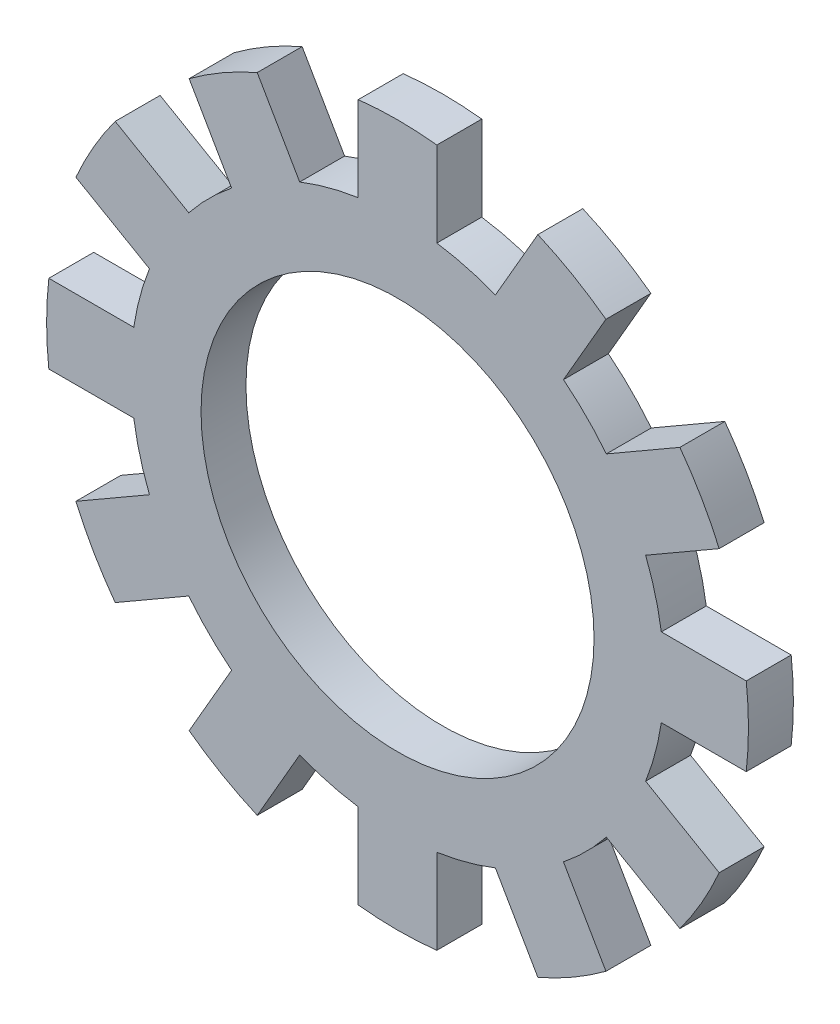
SolidWorks part; units mm, degrees
ref_plane "Front Plane" through (0, 0, 0) normal (0, 0, 1) x (1, 0, 0)
ref_plane "Top Plane" through (0, 0, 0) normal (0, 1, 0) x (1, 0, 0)
ref_plane "Right Plane" through (0, 0, 0) normal (1, 0, 0) x (0, 0, -1)
sketch "Sketch1" plane through (0, 0, 0) normal (0, 0, 1) x (1, 0, 0)
  circle A0 centre (0, 0) radius 3.5
  circle A1 centre (0, 0) radius 4.75
  dimension "D1" = 7
  dimension "D2" = 9.5
extrude "Boss-Extrude1" add sketch "Sketch1" along normal mid plane 0.8
sketch "Sketch2" plane through (0, 0, 0) normal (0, 0, 1) x (1, 0, 0)
  line L0 (0, 2.6811) -> (0, -2.8425) construction
sketch "Sketch3" plane through (0, 0, 0) normal (0, 0, 1) x (1, 0, 0)
  line L0 (-0.7, 6.2107) -> (-0.7, 4.6981)
  line L2 (0, 2.6811) -> (0, -2.8425) construction
  line L3 (0, 4.75) -> (0, 6.25)
  arc A0 (0, 6.25) -> (-0.7, 6.2107) centre (0, 0) ccw
  arc A1 (0, 4.75) -> (-0.7, 4.6981) centre (0, 0) ccw
  circle A2 centre (0, 0) radius 4.75 construction
  dimension "D2" = 6.25
  dimension "D1" = 0.7
extrude "Boss-Extrude2" add sketch "Sketch3" along normal mid plane 0.8
mirror "Mirror1" about plane through (0, 0, 0) normal (1, 0, 0) of "Boss-Extrude2"
pattern_circular "CirPattern2" count 12 over 360 about axis through (0, 0, 0) along (0, 0, 1) of "Boss-Extrude2", "Mirror1"
